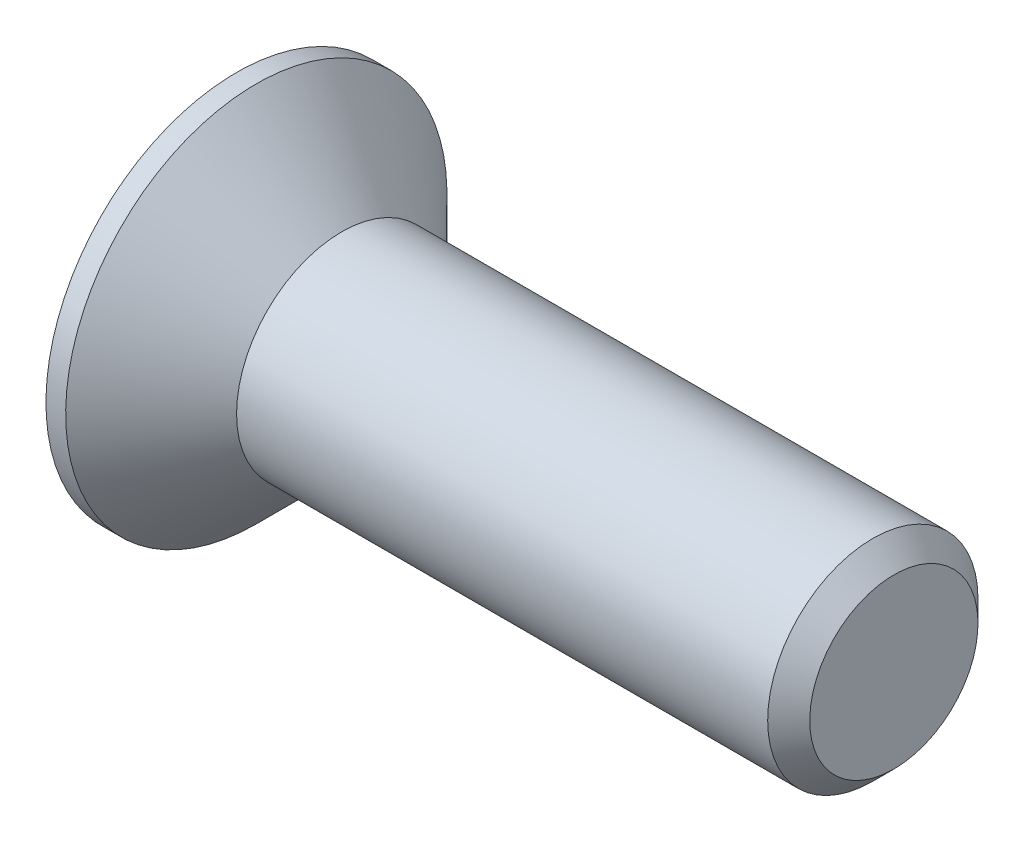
SolidWorks part; units mm, degrees
ref_plane "Front Plane" through (0, 0, 0) normal (0, 0, 1) x (1, 0, 0)
ref_plane "Top Plane" through (0, 0, 0) normal (0, 1, 0) x (1, 0, 0)
ref_plane "Right Plane" through (0, 0, 0) normal (1, 0, 0) x (0, 0, -1)
sketch "Sketch1" plane through (0, 0, 0) normal (0, 0, 1) x (1, 0, 0)
  line L1 (-4, 7.25) -> (-4, 0)
  line L2 (-4, 0) -> (21, 0)
  line L3 (21, 0) -> (21, 4)
  line L4 (21, 4) -> (0, 4)
  line L5 (-4, 7.25) -> (-3.25, 7.25)
  line L6 (-3.25, 7.25) -> (0, 4)
  dimension "D1" = 4
  dimension "D2" = 45
  dimension "D3" = 4
  dimension "D4" = 25
  dimension "D5" = 7.25
revolve "Revolve1" add sketch "Sketch1" angle 360 about L2
chamfer "Chamfer1" distance 0.8 angle 45 1 edges at (21, -4, 0)
sketch "Sketch2" plane through (-4, 0, 0) normal (-1, 0, 0) x (0, 0, 1)
  line L0 (-1.09, 4.35) -> (1.09, 4.35)
  line L1 (1.09, 4.35) -> (1.09, 1.09)
  line L2 (1.09, 1.09) -> (4.35, 1.09)
  line L3 (4.35, 1.09) -> (4.35, -1.09)
  line L4 (4.35, -1.09) -> (1.09, -1.09)
  line L5 (1.09, -1.09) -> (1.09, -4.35)
  line L6 (1.09, -4.35) -> (-1.09, -4.35)
  line L7 (-1.09, -4.35) -> (-1.09, -1.09)
  line L8 (-1.09, -1.09) -> (-4.35, -1.09)
  line L9 (-4.35, -1.09) -> (-4.35, 1.09)
  line L10 (-4.35, 1.09) -> (-1.09, 1.09)
  line L11 (-1.09, 1.09) -> (-1.09, 4.35)
  point P2 (0, 4.35)
  point P14 (0, -4.35)
  point P15 (4.35, 0)
  point P16 (-4.35, 0)
  dimension "D1" = 8.7
  dimension "D2" = 2.18
extrude "Cut-Extrude1" cut sketch "Sketch2" against normal blind 3.45
